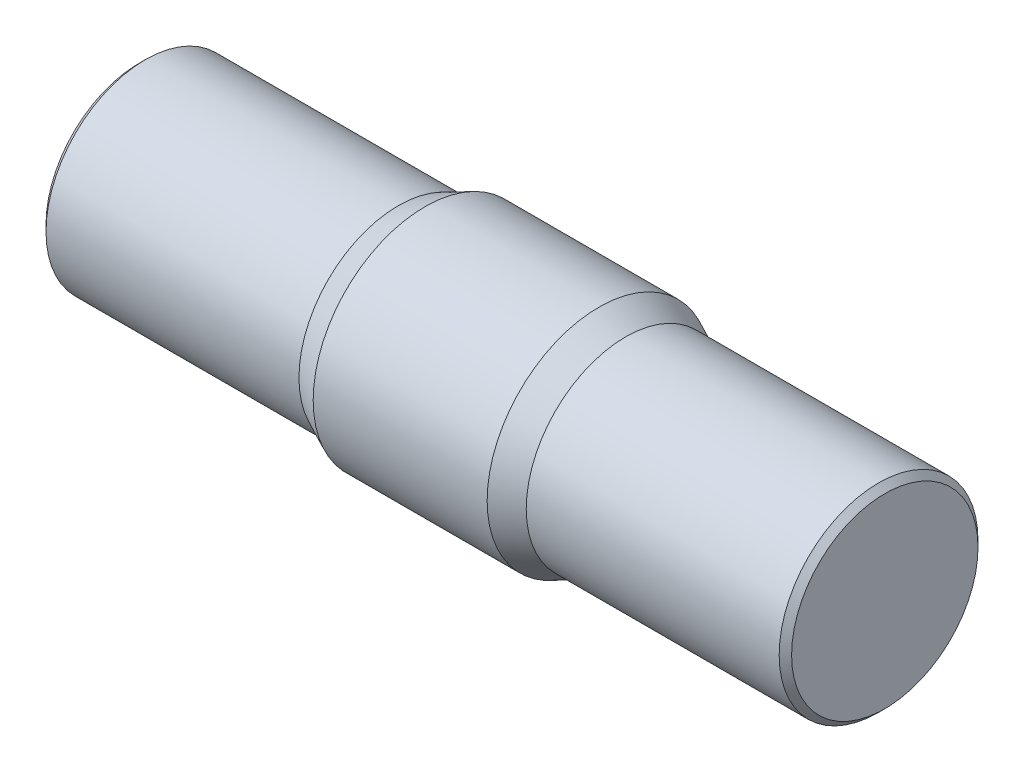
SolidWorks part; units mm, degrees
ref_plane "Plan de face" through (0, 0, 0) normal (0, 0, 1) x (1, 0, 0)
ref_plane "Plan de dessus" through (0, 0, 0) normal (0, 1, 0) x (1, 0, 0)
ref_plane "Plan de droite" through (0, 0, 0) normal (1, 0, 0) x (0, 0, -1)
sketch "Esquisse1" plane through (0, 0, 0) normal (0, 0, 1) x (1, 0, 0)
  line L0 (0, 0) -> (61.0683, 0) construction
  line L1 (0, 0) -> (0, 8)
  line L2 (0, 8) -> (20.8555, 8)
  line L3 (20.8555, 8) -> (23, 9)
  line L4 (23, 9) -> (37, 9)
  line L5 (37, 9) -> (39.1445, 8)
  line L6 (39.1445, 8) -> (60, 8)
  line L7 (60, 8) -> (60, 0)
  line L8 (0, 0) -> (60, 0)
  dimension "D1" = 25
  dimension "D2" = 25
  dimension "D3" = 18
  dimension "D4" = 16
  dimension "D5" = 14
  dimension "D6" = 60
revolve "Révolution1" add sketch "Esquisse1" angle 360 about L0
chamfer "Chanfrein1" distance 0.5 angle 45 2 edges at (60, 0, 8) (0, 0, 8)
